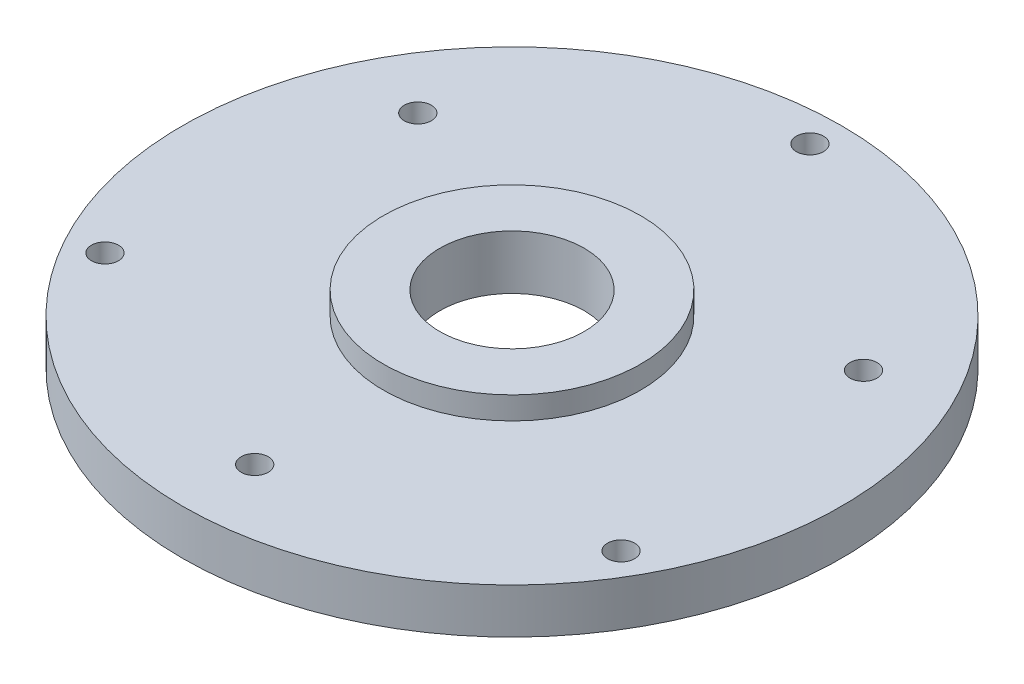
SolidWorks part; units mm, degrees
ref_plane "Piano frontale" through (0, 0, 0) normal (0, 0, 1) x (1, 0, 0)
ref_plane "Piano superiore" through (0, 0, 0) normal (0, 1, 0) x (1, 0, 0)
ref_plane "Piano destro" through (0, 0, 0) normal (1, 0, 0) x (0, 0, -1)
sketch "Schizzo1" plane through (0, 0, 0) normal (0, 0, 1) x (1, 0, 0)
  line L0 (0, 0) -> (0, 68.8521) construction
  line L4 (36.5, 39.3859) -> (36.5, 34.3859)
  line L10 (14, 34.3859) -> (36.5, 34.3859)
  line L11 (14, 34.3859) -> (14, 35.8859)
  line L12 (14, 35.8859) -> (8, 35.8859)
  line L15 (8, 41.8859) -> (14.25, 41.8859)
  line L16 (14.25, 41.8859) -> (14.25, 39.3859)
  line L17 (8, 35.8859) -> (8, 41.8859)
  line L18 (14.25, 39.3859) -> (36.5, 39.3859)
  dimension "D1" = 14.25
  dimension "D2" = 36.5
  dimension "D3" = 1.5
  dimension "D4" = 2.5
  dimension "D5" = 8
  dimension "D6" = 5
  dimension "D7" = 14
revolve "Rivoluzione1" add sketch "Schizzo1" angle 360 about L0
sketch "Schizzo2" plane through (0, 39.3859, 0) normal (0, 1, 0) x (1, 0, 0)
  circle A0 centre (0, 33) radius 1.5
  circle A1 centre (28.5788, -16.5) radius 1.5
  circle A2 centre (-28.5788, -16.5) radius 1.5
  point P10 (0, 0)
  dimension "D1" = 3
  dimension "D2" = 33
  dimension "D3" = 3
extrude "Taglio-Estrusione1" cut sketch "Schizzo2" against normal through all
sketch "Schizzo6" plane through (0, 34.3859, 0) normal (0, -1, 0) x (-1, 0, 0)
  circle A0 centre (0, -28.5) radius 1.5
  circle A1 centre (-24.6817, 14.25) radius 1.5
  circle A2 centre (24.6817, 14.25) radius 1.5
  point P10 (0, 0)
  dimension "D1" = 28.5
  dimension "D3" = 3
  dimension "D2" = 3
extrude "Taglio-Estrusione3" cut sketch "Schizzo6" against normal through all contours A1
